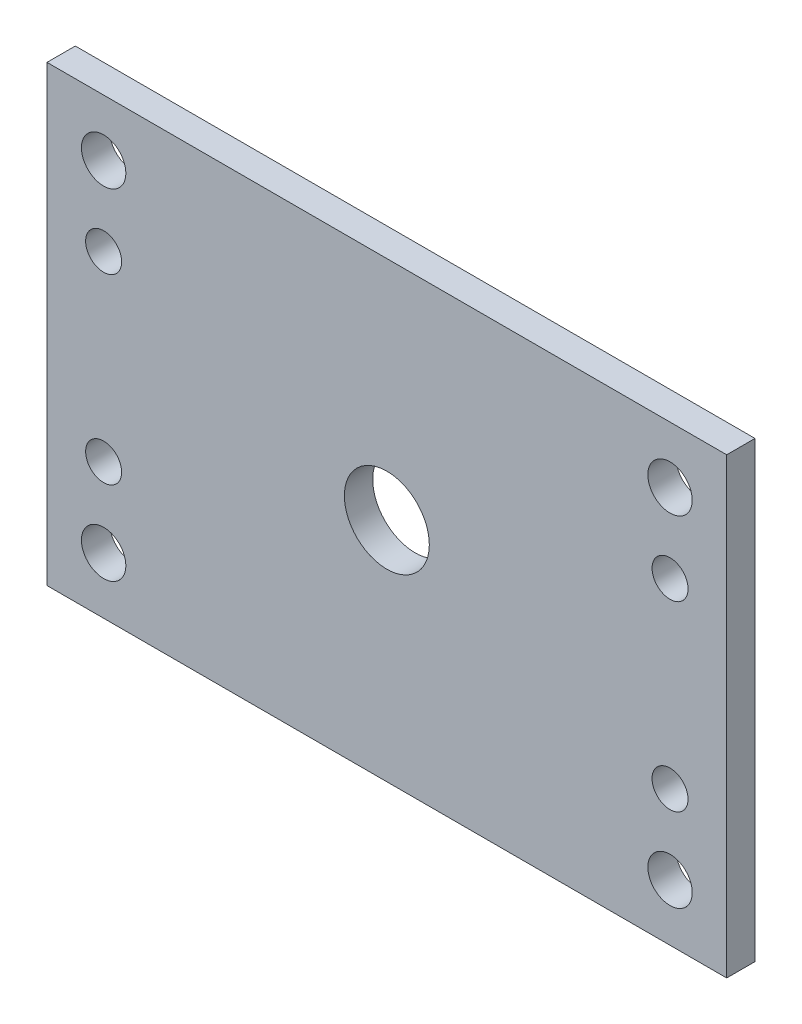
SolidWorks part; units mm, degrees
ref_plane "Front" through (0, 0, 0) normal (0, 0, 1) x (1, 0, 0)
ref_plane "Top" through (0, 0, 0) normal (0, 1, 0) x (1, 0, 0)
ref_plane "Right" through (0, 0, 0) normal (1, 0, 0) x (0, 0, -1)
sketch "Sketch1" plane through (0, 0, 0) normal (0, 0, 1) x (1, 0, 0)
  line L0 (6.35, 44.45) -> (69.85, 44.45) construction
  line L1 (0, 0) -> (76.2, 0)
  line L2 (0, 0) -> (0, 50.8)
  line L3 (0, 50.8) -> (76.2, 50.8)
  line L4 (76.2, 0) -> (76.2, 50.8)
  line L5 (69.85, 6.35) -> (69.85, 44.45) construction
  line L6 (6.35, 6.35) -> (69.85, 6.35) construction
  line L7 (6.35, 6.35) -> (6.35, 44.45) construction
  line L8 (6.35, 44.45) -> (69.85, 6.35) construction
  line L9 (6.35, 6.35) -> (69.85, 44.45) construction
  line L10 (0, 25.4) -> (76.2, 25.4) construction
  line L11 (6.35, 15.1892) -> (69.85, 15.1892) construction
  line L12 (6.35, 15.1892) -> (6.35, 35.6108) construction
  line L13 (6.35, 35.6108) -> (69.85, 35.6108) construction
  line L14 (69.85, 15.1892) -> (69.85, 35.6108) construction
  circle A0 centre (6.35, 44.45) radius 2.4892
  circle A1 centre (69.85, 44.45) radius 2.4892
  circle A2 centre (69.85, 6.35) radius 2.4892
  circle A3 centre (6.35, 6.35) radius 2.4892
  circle A4 centre (38.1, 25.4) radius 4.7625
  circle A5 centre (6.35, 35.6108) radius 2.0193
  circle A6 centre (6.35, 15.1892) radius 2.0193
  circle A7 centre (69.85, 15.1892) radius 2.0193
  circle A8 centre (69.85, 35.6108) radius 2.0193
  point P15 (6.35, 41.9608)
  point P16 (6.35, 8.8392)
  point P24 (69.85, 25.4)
  dimension "D4" = 4.9784
  dimension "D5" = 9.525
  dimension "D2" = 38.1
  dimension "D7" = 4.0386
  dimension "D1" = 76.2
  dimension "D6" = 20.4216
  dimension "D3" = 50.8
  dimension "D8" = 63.5
extrude "Boss-Extrude1" add sketch "Sketch1" along normal blind 3.175
